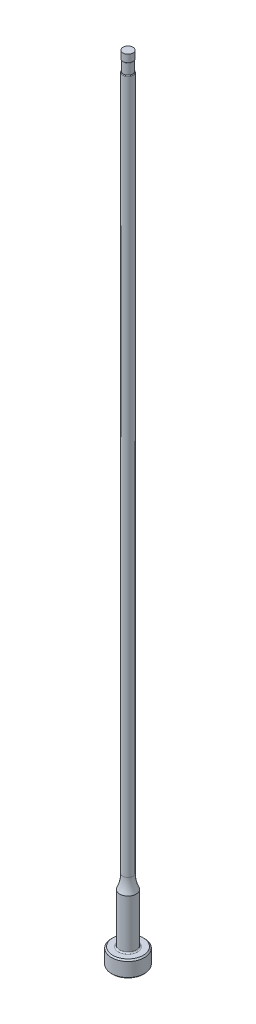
SolidWorks part; units mm, degrees
ref_plane "Front Plane" through (0, 0, 0) normal (0, 0, 1) x (1, 0, 0)
ref_plane "Top Plane" through (0, 0, 0) normal (0, 1, 0) x (1, 0, 0)
ref_plane "Right Plane" through (0, 0, 0) normal (1, 0, 0) x (0, 0, -1)
other "Configuration Table"
sketch "Sketch1" plane through (0, 0, 0) normal (0, 0, 1) x (1, 0, 0)
  line L0 (0, 259.9588) -> (0, -15.1925) construction
  line L1 (0, 0) -> (-3.175, 0)
  line L2 (-3.175, 0) -> (-3.175, 3.175)
  line L3 (-3.175, 3.175) -> (-1.5875, 3.175)
  line L4 (-0.9919, 15.3851) -> (-0.9919, 152.4)
  line L5 (-0.9919, 152.4) -> (0, 152.4)
  line L6 (0, 152.4) -> (0, 0)
  line L7 (-1.5875, 3.175) -> (-1.5875, 12.7)
  arc A1 (-1.5875, 12.7) -> (-0.9919, 15.3851) centre (-7.3419, 15.3851) ccw
  dimension "D1" = 6.35
  dimension "L" = 152.4
  dimension "D2" = 3.175
  dimension "H" = 6.35
  dimension "T" = 3.175
  dimension "D" = 1.9837
  dimension "S" = 12.7
revolve "Revolve1" add sketch "Sketch1" angle 360 about L0
chamfer "Chamfer1" distance 0.254 angle 45 2 edges at (0, 3.175, 3.175) (0, 0, 3.175)
fillet "Fillet1" radius 0.254 1 edges at (0, 3.175, 1.5875)
sketch "Sketch2" plane through (0, 0, 0) normal (0, 0, 1) x (1, 0, 0)
  line L0 (-0.9919, 152.4) -> (-0.9919, 15.3851) construction
  line L1 (-0.9919, 150.876) -> (-0.8903, 150.876)
  line L2 (-0.9919, 150.876) -> (-0.9919, 148.844)
  line L3 (-0.9919, 148.844) -> (-0.8903, 148.844)
  line L4 (-0.8903, 150.876) -> (-0.8903, 148.844)
  line L5 (0.9919, 152.4) -> (-0.9919, 152.4) construction
  line L6 (0, 153.4483) -> (0, 147.3282) construction
  dimension "D1" = 2.032
  dimension "N" = 1.524
  dimension "FD" = 0.1016
  dimension "D3" = 1.7805
revolve "Vent Relief" cut sketch "Sketch2" angle 360 about L6
sketch "Sketch3" plane through (0, 0, 0) normal (0, 0, 1) x (1, 0, 0)
  line L0 (-0.8903, 149.86) -> (-0.8903, 111.76)
  line L1 (-0.8903, 150.876) -> (-0.8903, 148.844) construction
  line L2 (-0.9919, 148.844) -> (-0.9919, 15.3851) construction
  line L3 (-0.9919, 110.9632) -> (-0.9919, 149.86)
  line L4 (-0.9919, 149.86) -> (-0.8903, 149.86)
  arc A0 (-0.8903, 111.76) -> (-0.9919, 110.9632) centre (-4.0653, 111.76) cw
  dimension "D1" = 3.175
  dimension "D2" = 38.1
extrude "D-Slot" cut sketch "Sketch3" against normal through all both and the other way through all
sketch "Sketch5" plane through (0, 0, 0) normal (0, 0, 1) x (1, 0, 0)
  line L0 (-0.9919, 150.876) -> (0.9919, 150.876) construction
  line L1 (-0.9919, 152.4) -> (-0.9665, 152.4)
  line L2 (-0.9919, 152.4) -> (-0.9919, 150.876)
  line L3 (-0.9919, 150.876) -> (-0.9665, 150.876)
  line L4 (-0.9665, 152.4) -> (-0.9665, 150.876)
  line L5 (0, 152.6877) -> (0, 150.5771) construction
  dimension "VP" = 0.0254
revolve "Vent Diameter" cut sketch "Sketch5" angle 360 about L5
fillet "Fillet2" radius 0.127 2 edges at (0.9919, 148.844, 0) (0, 150.876, 0.9665)
sketch "Pocket Sketch" plane through (0, 0, 0) normal (0, 0, 1) x (1, 0, 0)
  line L0 (-3.5719, 0) -> (-3.5719, 3.2004)
  line L1 (-3.5719, 3.2004) -> (-1.9523, 3.2004)
  line L2 (-1.1903, 3.9624) -> (-1.1903, 22.225)
  line L3 (-1.1903, 22.225) -> (0, 22.225)
  line L4 (0, 22.225) -> (0, 0)
  line L5 (0, 0) -> (-3.5719, 0)
  line L6 (0, 12.6104) -> (0, -2.4989) construction
  line L7 (-3.175, 2.921) -> (-3.175, 0.254) construction
  line L8 (2.921, 3.175) -> (-2.921, 3.175) construction
  line L9 (-0.9919, 110.9632) -> (-0.9919, 15.3851) construction
  line L10 (-1.9523, 3.2004) -> (-1.1903, 3.9624)
  point P3 (-1.1903, 3.2004)
  dimension "D1" = 7.1437
  dimension "D2" = 0.3969
  dimension "D3" = 0.0254
  dimension "D4" = 0.1984
  dimension "D5" = 2.3806
  dimension "D6" = 22.225
